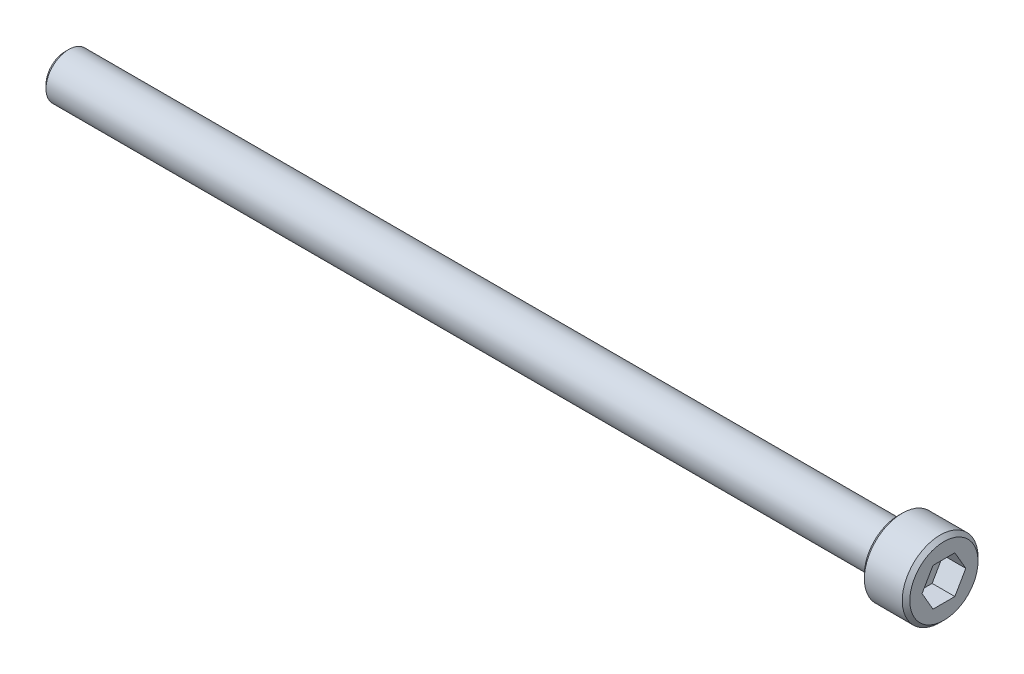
SolidWorks part; units mm, degrees
ref_plane "Plan de face" through (0, 0, 0) normal (0, 0, 1) x (1, 0, 0)
ref_plane "Plan de dessus" through (0, 0, 0) normal (0, 1, 0) x (1, 0, 0)
ref_plane "Plan de droite" through (0, 0, 0) normal (1, 0, 0) x (0, 0, -1)
sketch "Esquisse1" plane through (0, 0, 0) normal (0, 0, 1) x (1, 0, 0)
  line L0 (0, 0) -> (-116, 0) construction
  line L1 (-116, 0) -> (-116, 3)
  line L2 (-116, 3) -> (-6, 3)
  line L3 (-6, 3) -> (-6, 5)
  line L4 (-6, 5) -> (0, 5)
  line L5 (0, 5) -> (0, 0)
  line L6 (0, 0) -> (-116, 0)
  point P3 (-115.8666, 3)
  dimension "D1" = 6
  dimension "D2" = 110
  dimension "D3" = 6
  dimension "D4" = 10
revolve "Révolution1" add sketch "Esquisse1" angle 360 about L0
sketch "Esquisse2" plane through (0, 0, 0) normal (1, 0, 0) x (0, 0, -1)
  line L1 (2.8868, 0) -> (1.4434, 2.5)
  line L2 (1.4434, 2.5) -> (-1.4434, 2.5)
  line L3 (-1.4434, 2.5) -> (-2.8868, 0)
  line L4 (-2.8868, 0) -> (-1.4434, -2.5)
  line L5 (-1.4434, -2.5) -> (1.4434, -2.5)
  line L6 (1.4434, -2.5) -> (2.8868, 0)
  circle A0 centre (0, 0) radius 2.5 construction
  point P1 (0, 0)
  dimension "D1" = 5
extrude "Enlèv. mat.-Extru.1" cut sketch "Esquisse2" against normal blind 3
chamfer "Chanfrein2" distance 0.5 angle 45 3 edges at (0, 5, 0) (-6, 5, 0) (-116, 3, 0)
